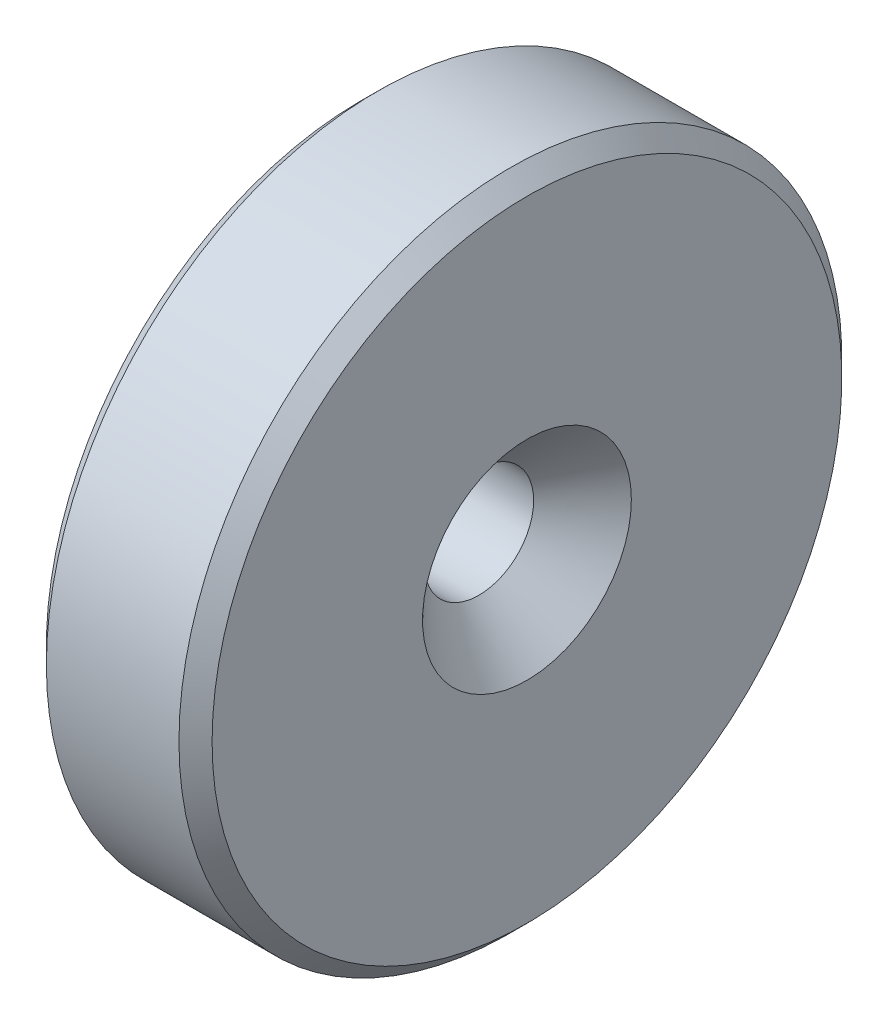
SolidWorks part; units mm, degrees
ref_plane "Plan1" through (0, 0, 0) normal (0, 0, 1) x (1, 0, 0)
ref_plane "Plan2" through (0, 0, 0) normal (0, 1, 0) x (1, 0, 0)
ref_plane "Plan3" through (0, 0, 0) normal (1, 0, 0) x (0, 0, -1)
sketch "Esquisse1" plane through (0, 0, 0) normal (0, 0, 1) x (1, 0, 0)
  line L0 (0, 0) -> (20, 0) construction
  line L2 (0, 0) -> (10, 0)
  line L3 (0, 0) -> (0, 20)
  line L4 (0, 20) -> (10, 20)
  line L5 (10, 0) -> (10, 20)
  dimension "D1" = 10
  dimension "D2" = 20
revolve "Base-Révolution" add sketch "Esquisse1" angle 360 about L0
chamfer "Chanfrein1" distance 1 angle 45
hole_wizard "Perçage1" positions "Esquisse3" profile "Esquisse2" countersink size "M6" standard "ISO"
sketch "Esquisse3" plane through (10, 0, 0) normal (1, 0, 0) x (0, 0, -1)
  circle A0 centre (0, 0) radius 20 construction
  point P0 (0, 0)
sketch "Esquisse2" plane through (10, 0, 0) normal (0, 1, 0) x (0, 0, -1)
  line L0 (0, 0) -> (0, 10)
  line L1 (0, 10) -> (3.3, 10)
  line L2 (3.3, 10) -> (3.3, 2.8971)
  line L3 (3.3, 2.8971) -> (6.3, 0)
  line L5 (6.3, 0) -> (0, 0)
  line L6 (-3.3, 2.8971) -> (-6.3, 0) construction
  line L11 (0, -6.35) -> (0, 107.95) construction
  dimension "Diamètre du perçage jusqu'au prochain" = 6.6
  dimension "Profondeur du perçage jusqu'au prochain" = 10
  dimension "Diamètre du fraisage entrant" = 12.6
  dimension "Angle du fraisage entrant" = 92
sketch "Esquisse5" plane through (0, 0, 0) normal (0, 1, 0) x (1, 0, 0)
  line L0 (0, 0) -> (10, 0) construction
  line L2 (-2, 0.125) -> (0.1, 0.125)
  line L3 (-2, 0.125) -> (-2, -0.125)
  line L4 (-2, -0.125) -> (0.1, -0.125)
  line L5 (0.1, 0.125) -> (0.1, -0.125)
  dimension "D1" = 2
  dimension "D2" = 0.25
  dimension "D3" = 2.1
extrude "Enlèv. mat.-Extru.1" cut sketch "Esquisse5" against normal mid plane 40
